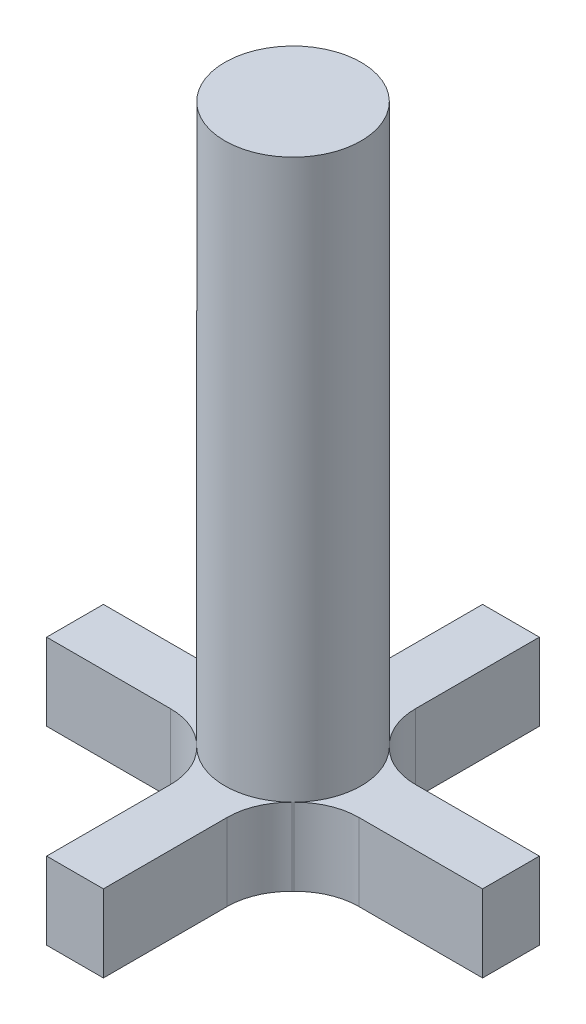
SolidWorks part; units mm, degrees
ref_plane "Front Plane" through (0, 0, 0) normal (0, 0, 1) x (1, 0, 0)
ref_plane "Top Plane" through (0, 0, 0) normal (0, 1, 0) x (1, 0, 0)
ref_plane "Right Plane" through (0, 0, 0) normal (1, 0, 0) x (0, 0, -1)
sketch "Sketch2" plane through (0, 0, 0) normal (0, 1, 0) x (1, 0, 0)
  circle A0 centre (0, 0) radius 3.81
  dimension "D1" = 7.62
extrude "Boss-Extrude1" add sketch "Sketch2" along normal blind 35.56
sketch "Sketch3" plane through (0, 0, 0) normal (0, -1, 0) x (1, 0, 0)
  line L1 (-12.192, 1.5875) -> (12.192, 1.5875)
  line L2 (-12.192, 1.5875) -> (-12.192, -1.5875)
  line L3 (-12.192, -1.5875) -> (12.192, -1.5875)
  line L4 (12.192, 1.5875) -> (12.192, -1.5875)
  line L5 (-12.192, 1.5875) -> (12.192, -1.5875) construction
  line L6 (-12.192, -1.5875) -> (12.192, 1.5875) construction
  line L7 (-1.5875, 12.192) -> (1.5875, 12.192)
  line L8 (-1.5875, 12.192) -> (-1.5875, -12.192)
  line L9 (-1.5875, -12.192) -> (1.5875, -12.192)
  line L10 (1.5875, 12.192) -> (1.5875, -12.192)
  line L11 (-1.5875, 12.192) -> (1.5875, -12.192) construction
  line L12 (-1.5875, -12.192) -> (1.5875, 12.192) construction
  point P0 (0, 0)
  point P6 (0, 0)
  dimension "D1" = 3.175
  dimension "D2" = 3.175
  dimension "D3" = 24.384
extrude "Boss-Extrude2" add sketch "Sketch3" against normal blind 4.318 contours L10 L7 L8 M9 | L4 L1 L3 M9 | L2 L3 L1 M9 | L10 L8 L9 M9
fillet "Fillet1" radius 3.556 8 edges at (1.5875, 2.159, -3.4635) (3.4635, 2.159, -1.5875) (-1.5875, 2.159, -3.4635) (-3.4635, 2.159, -1.5875) (-3.4635, 2.159, 1.5875) (-1.5875, 2.159, 3.4635) (1.5875, 2.159, 3.4635) (3.4635, 2.159, 1.5875)
